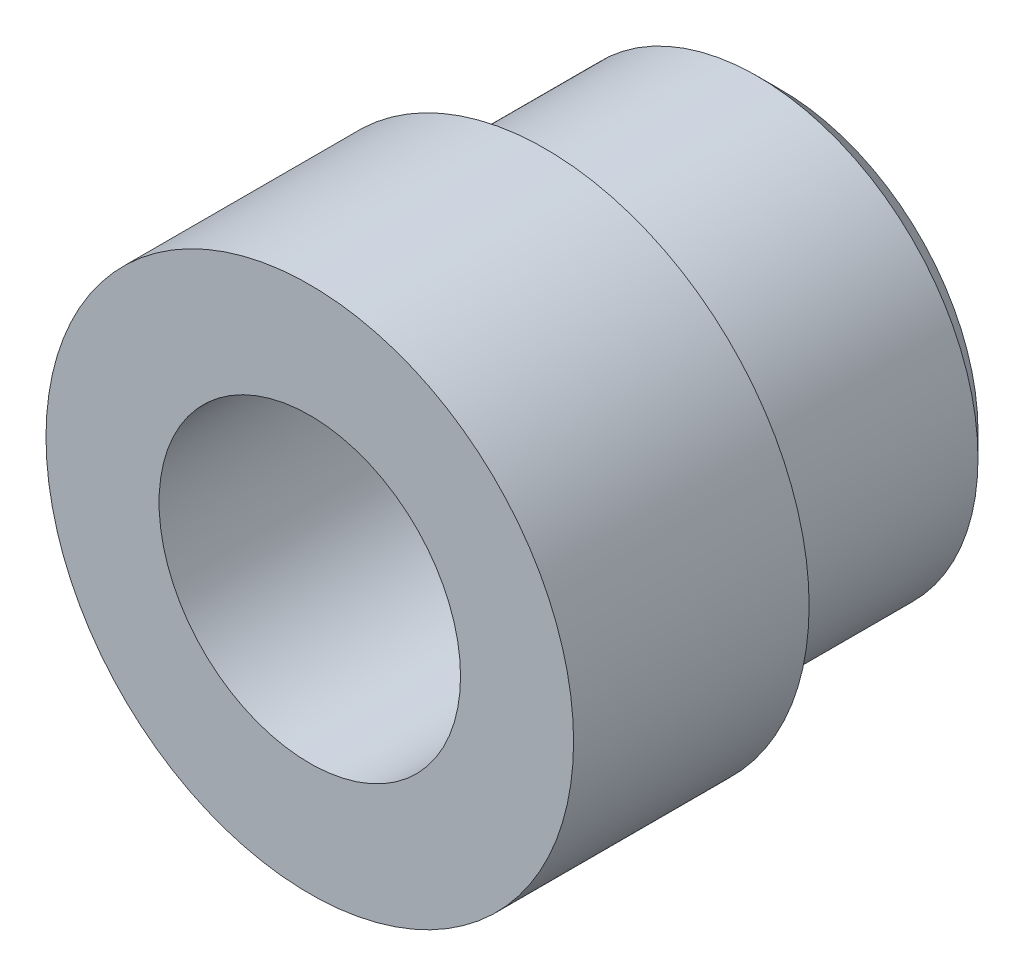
SolidWorks part; units mm, degrees
ref_plane "Front" through (0, 0, 0) normal (0, 0, 1) x (1, 0, 0)
ref_plane "Top" through (0, 0, 0) normal (0, 1, 0) x (1, 0, 0)
ref_plane "Right" through (0, 0, 0) normal (1, 0, 0) x (0, 0, -1)
sketch "Sketch1" plane through (0, 0, 0) normal (1, 0, 0) x (0, 0, -1)
  line L0 (0, 0) -> (56.7407, 0) construction
  line L1 (22.745, 8.128) -> (22.745, 14.224)
  line L2 (22.745, 14.224) -> (35.445, 14.224)
  line L3 (35.445, 14.224) -> (35.445, 10.6299)
  line L4 (35.445, 10.6299) -> (36.715, 11.8999)
  line L5 (36.715, 11.8999) -> (46.875, 11.8999)
  line L6 (46.875, 11.8999) -> (48.145, 10.6299)
  line L7 (48.145, 10.6299) -> (48.145, 8.128)
  line L8 (22.745, 8.128) -> (48.145, 8.128)
  dimension "NUTID" = 16.256
  dimension "NUTOD" = 28.448
  dimension "NUTLength" = 25.4
  dimension "NUTThreadLength" = 12.7
  dimension "NUTThreadInside" = 1.27
  dimension "NUTThreadOutside" = 1.27
  dimension "NUTThreadOD" = 23.7998
  dimension "NUTThreadUnderCut" = 1.27
revolve "Revolve1" add sketch "Sketch1" angle 360 about L0
equation "\"NUTThreadUnderCut@Sketch1\" = .1*\"NUTThreadLength@Sketch1\""
equation "\"NUTThreadOutside@Sketch1\"=.1*\"NUTThreadLength@Sketch1\""
equation "\"NUTThreadInside@Sketch1\"=.1*\"NUTThreadLength@Sketch1\""
